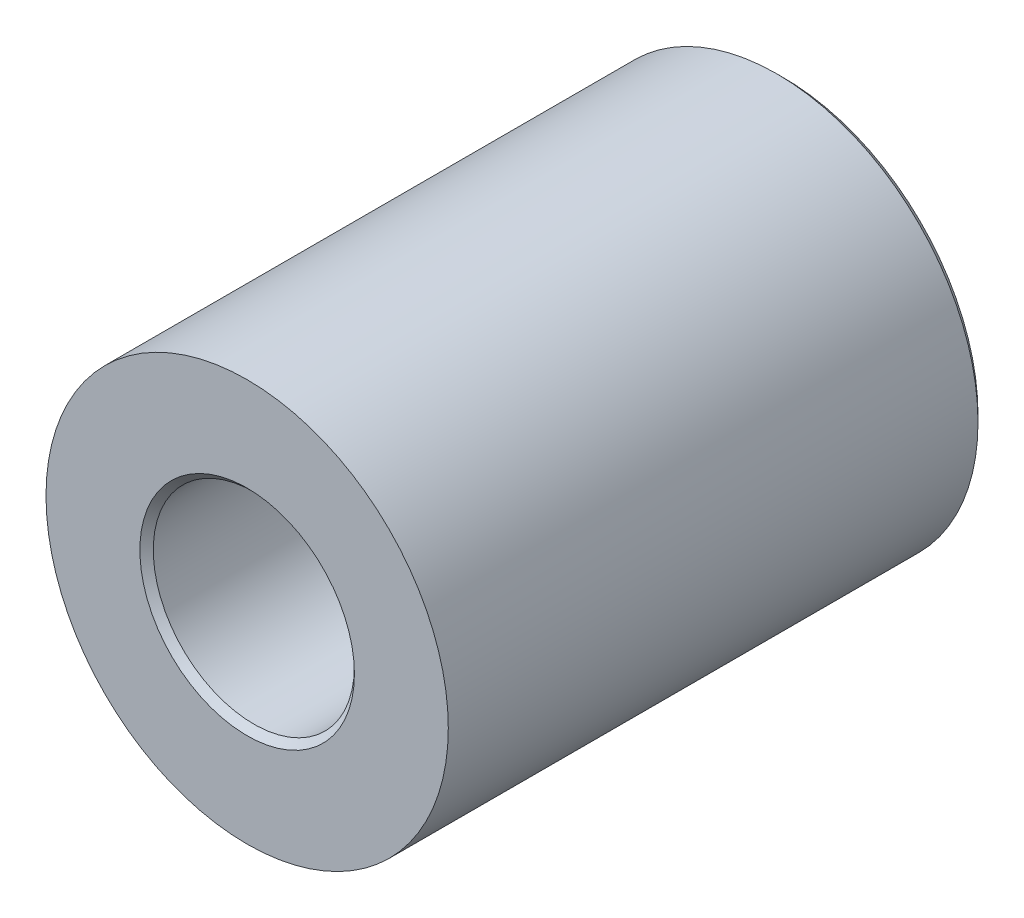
SolidWorks part; units mm, degrees
ref_plane "Frontal" through (0, 0, 0) normal (0, 0, 1) x (1, 0, 0)
ref_plane "Horizontal" through (0, 0, 0) normal (0, 1, 0) x (1, 0, 0)
ref_plane "Vertical" through (0, 0, 0) normal (1, 0, 0) x (0, 0, -1)
sketch "Esquisse1" plane through (0, 0, 0) normal (0, 0, 1) x (1, 0, 0)
  circle A0 centre (0, 0) radius 3
  dimension "D1" = 6
extrude "Extrusion2" add sketch "Esquisse1" along normal blind 8
sketch "Esquisse2" plane through (0, 0, 8) normal (0, 0, 1) x (1, 0, 0)
  line L0 (0, 5.3636) -> (0, -4.9645) construction
  line L1 (-5.7617, 0) -> (6.2792, 0) construction
  circle A0 centre (0, 0) radius 1.5
  dimension "D1" = 3
extrude "Extrusion3" cut sketch "Esquisse2" against normal through all
chamfer "Chanfrein4" distance 0.1 angle 45 1 edges at (3, 0, 0)
chamfer "Chanfrein5" distance 0.1 angle 45 1 edges at (1.5, 0, 8)
